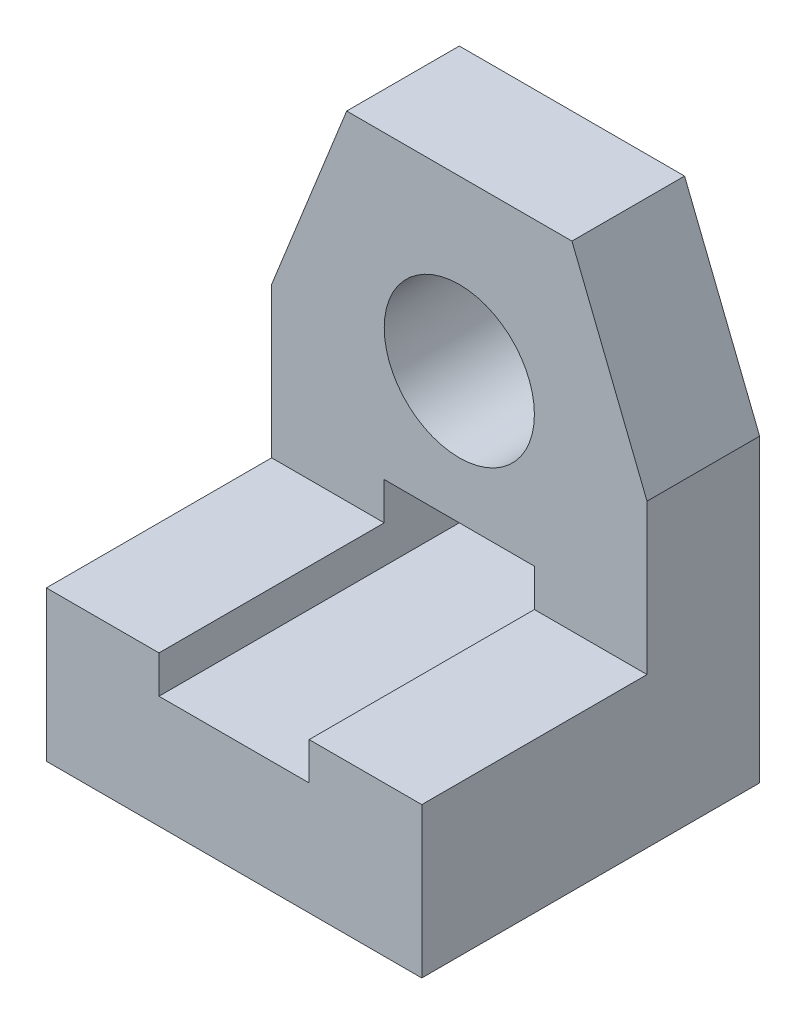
SolidWorks part; units mm, degrees
ref_plane "前视基准面" through (0, 0, 0) normal (0, 0, 1) x (1, 0, 0)
ref_plane "上视基准面" through (0, 0, 0) normal (0, 1, 0) x (1, 0, 0)
ref_plane "右视基准面" through (0, 0, 0) normal (1, 0, 0) x (0, 0, -1)
sketch "草图1" plane through (0, 0, 0) normal (0, 1, 0) x (1, 0, 0)
  line L1 (0, 0) -> (50, 0)
  line L2 (0, 0) -> (0, 45)
  line L3 (0, 45) -> (50, 45)
  line L4 (50, 0) -> (50, 45)
  dimension "D1" = 50
  dimension "D2" = 45
extrude "拉伸1" add sketch "草图1" along normal blind 20
sketch "草图2" plane through (0, 0, -45) normal (0, 0, -1) x (-1, 0, 0)
  line L0 (-50, 20) -> (-50, 40)
  line L1 (-50, 40) -> (-40, 65)
  line L2 (-40, 65) -> (-10, 65)
  line L3 (-25, 20) -> (-25, 65) construction
  line L4 (-50, 20) -> (0, 20) construction
  line L5 (0, 40) -> (-10, 65)
  line L6 (0, 20) -> (0, 40)
  line L7 (0, 20) -> (-50, 20)
  circle A0 centre (-25, 42.5) radius 10
  point P10 (-25, 65)
  dimension "D4" = 20
  dimension "D1" = 20
  dimension "D2" = 45
  dimension "D3" = 15
extrude "拉伸2" add sketch "草图2" against normal blind 15
sketch "草图3" plane through (0, 0, 0) normal (0, 0, 1) x (1, 0, 0)
  line L0 (25, 20) -> (25, 28.8742) construction
  line L1 (50, 20) -> (0, 20) construction
  line L2 (0, 20) -> (50, 20) construction
  line L3 (15, 25) -> (35, 25)
  line L4 (15, 25) -> (15, 15)
  line L5 (15, 15) -> (35, 15)
  line L6 (35, 25) -> (35, 15)
  dimension "D1" = 5
  dimension "D2" = 5
  dimension "D3" = 20
extrude "切除-拉伸1" cut sketch "草图3" against normal through all
